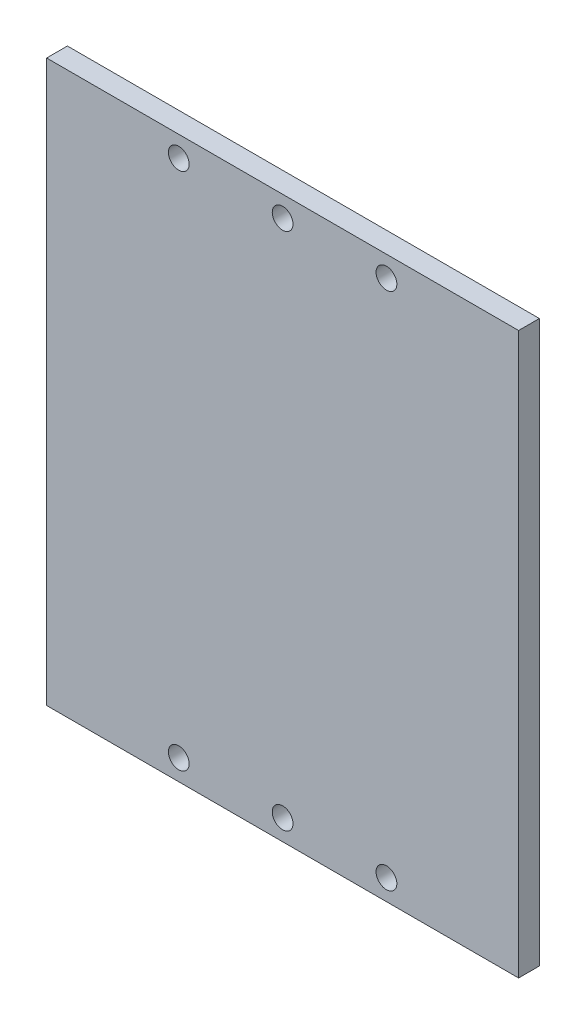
SolidWorks part; units mm, degrees
ref_plane "Front Plane" through (0, 0, 0) normal (0, 0, 1) x (1, 0, 0)
ref_plane "Top Plane" through (0, 0, 0) normal (0, 1, 0) x (1, 0, 0)
ref_plane "Right Plane" through (0, 0, 0) normal (1, 0, 0) x (0, 0, -1)
sketch "Sketch1" plane through (0, 0, 0) normal (0, 0, 1) x (1, 0, 0)
  line L0 (-25.9079, 1) -> (-9.7538, 1)
  line L5 (13.97, 5) -> (13.97, -35) construction
  line L7 (-31.4777, -1) -> (13.97, -1)
  line L8 (-7.7538, 1) -> (8.4003, 1)
  line L9 (-25.9079, -3) -> (-9.7538, -3)
  line L10 (-7.7538, -3) -> (8.4003, -3)
  line L11 (-25.9079, -7) -> (-9.7538, -7)
  line L12 (-7.7538, -7) -> (8.4003, -7)
  line L13 (-25.9079, -11) -> (-9.7538, -11)
  line L14 (-7.7538, -11) -> (8.4003, -11)
  line L15 (-25.9079, -15) -> (-9.7538, -15)
  line L16 (-7.7538, -15) -> (8.4003, -15)
  line L17 (-25.9079, -19) -> (-9.7538, -19)
  line L18 (-7.7538, -19) -> (8.4003, -19)
  line L19 (-25.9079, -23) -> (-9.7538, -23)
  line L20 (-7.7538, -23) -> (8.4003, -23)
  line L21 (-25.9079, -27) -> (-9.7538, -27)
  line L22 (-7.7538, -27) -> (8.4003, -27)
  line L23 (-25.9079, -31) -> (-9.7538, -31)
  line L24 (-7.7538, -31) -> (8.4003, -31)
  line L25 (-25.9079, -35) -> (-9.7538, -35)
  line L26 (-7.7538, -35) -> (8.4003, -35)
  line L27 (-25.9079, -39) -> (-9.7538, -39)
  line L28 (-7.7538, -39) -> (8.4003, -39)
  line L29 (-25.9079, -43) -> (-9.7538, -43)
  line L30 (-7.7538, -43) -> (8.4003, -43)
  line L31 (-31.4777, -33) -> (13.97, -33)
  line L32 (-31.4777, -37) -> (13.97, -37)
  line L33 (-31.4777, -41) -> (13.97, -41)
  line L37 (-31.4777, -5) -> (13.97, -5)
  line L38 (-31.4777, -9) -> (13.97, -9)
  line L39 (-31.4777, -13) -> (13.97, -13)
  line L40 (-31.4777, -17) -> (13.97, -17)
  line L41 (-31.4777, -21) -> (13.97, -21)
  line L42 (-31.4777, -25) -> (13.97, -25)
  line L43 (-31.4777, -29) -> (13.97, -29)
  point P0 (0, 0)
sketch "Croquis1" plane through (0, 0, 0) normal (0, 0, 1) x (1, 0, 0)
  line L0 (-7.7538, 1) -> (8.4003, 1) construction
  line L1 (-31.48, 5) -> (13.97, 5)
  line L2 (-31.48, 5) -> (-31.48, -49)
  line L3 (-31.48, -49) -> (13.97, -49)
  line L4 (13.97, 5) -> (13.97, -49)
  line L5 (13.97, -22) -> (-31.48, -22) construction
  circle A1 centre (-8.755, -47) radius 1
  circle A2 centre (1.245, -47) radius 1
  circle A3 centre (-18.755, -47) radius 1
  circle A7 centre (1.245, 3) radius 1
  circle A8 centre (-8.755, 3) radius 1
  circle A9 centre (-18.755, 3) radius 1
  point P4 (-8.755, 5)
  point P8 (0.3232, 1)
extrude "Saliente-Extruir2" add sketch "Croquis1" along normal blind 2
equation "\"T\"= 2'Material thickness (mm)"
equation "\"k\"= 0.2'kerf mm"
equation "\"theta\"= 270'Total bend angle DEG"
equation "\"theta_rad\"= 3.14159 * \"theta\" / 180'Total bend angle RAD"
equation "\"n\"= round ( ( \"theta_rad\" / ( 3.14159 / 4 - arccos ( ( \"k\" + \"T\" ) / ( 2 * sqr ( ( \"T\" ^ 2 ) / 2 ) ) ) ) ) / 2 )'Minimum number of columns of torsional links"
equation "\"tallow\"= 20'Torsional Stress Allowed MPA"
equation "\"G\"= 1500'Torsional Modulus of the material (Pa)"
equation "\"l\"= 0.676125 * ( \"theta_rad\" * \"G\" * \"T\" ) / ( \"tallow\" * \"n\" )"
equation "\"D1@Sketch1\"=\"T\""
equation "\"D2@Sketch1\"=\"l\""
equation "\"D3@Sketch1\"=\"l\""
equation "\"D4@Sketch1\"=\"T\""
equation "\"D7@Sketch1\"=\"n\"/2 + 1"
equation "\"D9@Sketch1\"=\"n\"/2"
equation "\"D11@Sketch1\"=\"T\"*2"
equation "\"D10@Sketch1\"=\"T\"*2"
equation "\"distancia_rectangulo\"= 45.45'Ancho del rectangulo"
equation "\"D1@Croquis1\"=\"distancia_rectangulo\""
equation "\"largo_rectangulo\"= \"T\" * \"n\" + 10'altura total del rectangulo"
equation "\"D2@Croquis1\"=\"largo_rectangulo\""
equation "\"D1@Saliente-Extruir2\"=\"T\""
equation "\"D9@Croquis1\"=\"largo_rectangulo\"/2"
